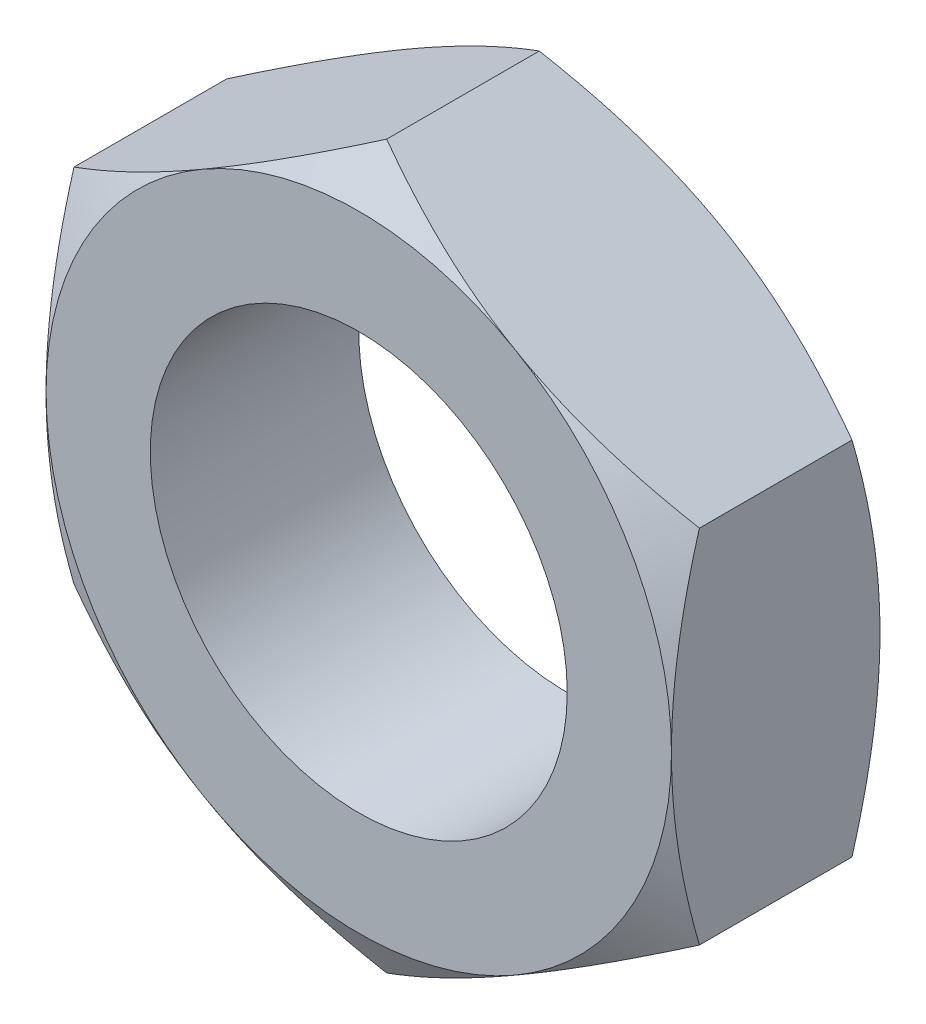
SolidWorks part; units mm, degrees
ref_plane "Plan1" through (0, 0, 0) normal (0, 0, 1) x (1, 0, 0)
ref_plane "Plan2" through (0, 0, 0) normal (0, 1, 0) x (1, 0, 0)
ref_plane "Plan3" through (0, 0, 0) normal (1, 0, 0) x (0, 0, -1)
sketch "Esquisse1" plane through (0, 0, 0) normal (0, 0, 1) x (1, 0, 0)
  line L0 (0, 0) -> (15, 0) construction
  line L1 (15, -8.6603) -> (15, 8.6603)
  line L2 (0, 0) -> (15, 8.6603) construction
  line L3 (0, 0) -> (0, 17.3205) construction
  line L4 (15, 8.6603) -> (0, 17.3205)
  line L5 (15, -8.6603) -> (0, -17.3205)
  line L6 (-15, -8.6603) -> (0, -17.3205)
  line L7 (-15, -8.6603) -> (-15, 8.6603)
  line L8 (-15, 8.6603) -> (0, 17.3205)
  circle A0 centre (0, 0) radius 15 construction
  circle A1 centre (0, 0) radius 17.3205 construction
  dimension "D2" = 30
  dimension "D1" = 30
extrude "Base-Extrusion" add sketch "Esquisse1" against normal blind 10
sketch "Esquisse2" plane through (0, 0, 0) normal (0, 1, 0) x (1, 0, 0)
  line L0 (-15, 0) -> (-24.6603, 0)
  line L1 (0, 10) -> (0, 0) construction
  line L2 (-15, 10) -> (-24.6603, 10)
  line L3 (-24.6603, 10) -> (-24.6603, 0)
  line L5 (-23.6603, 5) -> (-15, 10)
  line L6 (0, 10) -> (0, 0) construction
  line L7 (-15, 0) -> (-23.6603, 5)
  dimension "D1" = 30
  dimension "D2" = 1
  dimension "D3" = 30
revolve "Enlèvement de matière-Révolution1" cut sketch "Esquisse2" angle 360 about L6
sketch "Esquisse3" plane through (0, 0, 0) normal (0, 0, 1) x (1, 0, 0)
  circle A0 centre (0, 0) radius 10
  dimension "D1" = 20
extrude "Enlèv. mat.-Extru.1" cut sketch "Esquisse3" against normal through all
